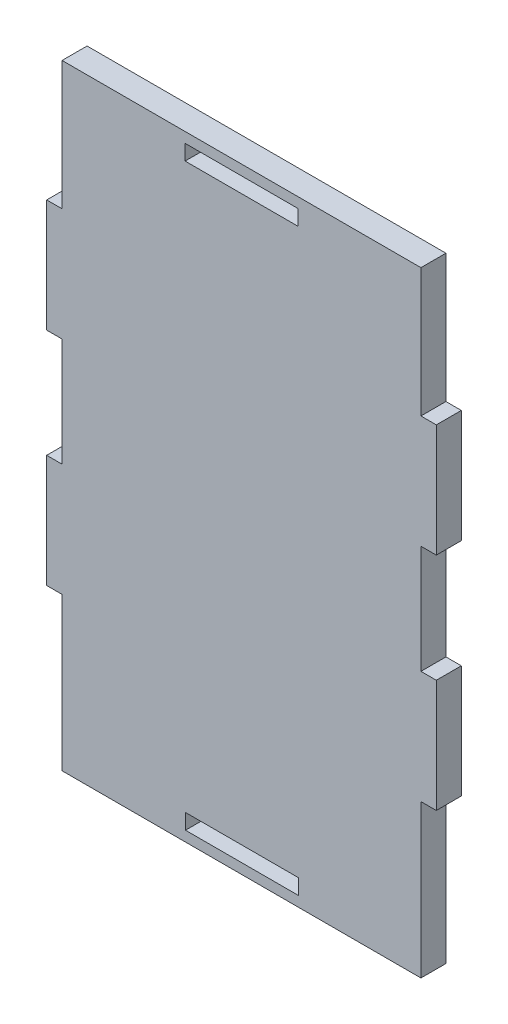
SolidWorks part; units mm, degrees
ref_plane "Front Plane" through (0, 0, 0) normal (0, 0, 1) x (1, 0, 0)
ref_plane "Top Plane" through (0, 0, 0) normal (0, 1, 0) x (1, 0, 0)
ref_plane "Right Plane" through (0, 0, 0) normal (1, 0, 0) x (0, 0, -1)
sketch "Sketch1" plane through (0, 0, 0) normal (0, 0, 1) x (1, 0, 0)
  line L0 (0, -47.06) -> (0, -68.2)
  line L1 (0, 0) -> (70, 0)
  line L2 (0, 0) -> (0, -25.06)
  line L3 (0, -120) -> (70, -120)
  line L4 (70, 0) -> (70, -25.06)
  line L5 (0, -25.06) -> (-3, -25.06)
  line L6 (0, -90.2) -> (0, -120)
  line L7 (0, -47.06) -> (-3, -47.06)
  line L8 (-3, -25.06) -> (-3, -47.06)
  line L9 (0, -68.2) -> (-3, -68.2)
  line L10 (35, 0) -> (35, -120) construction
  line L11 (0, -90.2) -> (-3, -90.2)
  line L12 (-3, -68.2) -> (-3, -90.2)
  line L13 (70, -47.06) -> (70, -68.2)
  line L14 (70, -68.2) -> (73, -68.2)
  line L15 (73, -68.2) -> (73, -90.2)
  line L16 (70, -90.2) -> (73, -90.2)
  line L17 (70, -25.06) -> (73, -25.06)
  line L18 (70, -47.06) -> (73, -47.06)
  line L19 (73, -25.06) -> (73, -47.06)
  line L20 (0, -57.63) -> (70, -57.63) construction
  line L21 (70, -90.2) -> (70, -120)
  line L22 (23.9979, -2) -> (45.9979, -2)
  line L23 (23.9979, -2) -> (23.9979, -5)
  line L24 (23.9979, -5) -> (45.9979, -5)
  line L25 (45.9979, -2) -> (45.9979, -5)
  line L28 (24.0773, -115) -> (46.0773, -115)
  line L29 (24.0773, -115) -> (24.0773, -118)
  line L30 (24.0773, -118) -> (46.0773, -118)
  line L31 (46.0773, -115) -> (46.0773, -118)
  point P27 (21.9951, -118)
  point P32 (21.2333, -118)
  point P33 (24.0773, -118)
  dimension "D1" = 120
  dimension "D2" = 70
  dimension "D3" = 29.8
  dimension "D4" = 22
  dimension "D5" = 25.06
  dimension "D6" = 22
  dimension "D7" = 3
  dimension "D8" = 3
  dimension "D9" = 5
  dimension "D10" = 3
  dimension "D11" = 22
  dimension "D12" = 2
  dimension "D13" = 3
  dimension "D14" = 22
extrude "Boss-Extrude1" add sketch "Sketch1" along normal blind 4.8793
